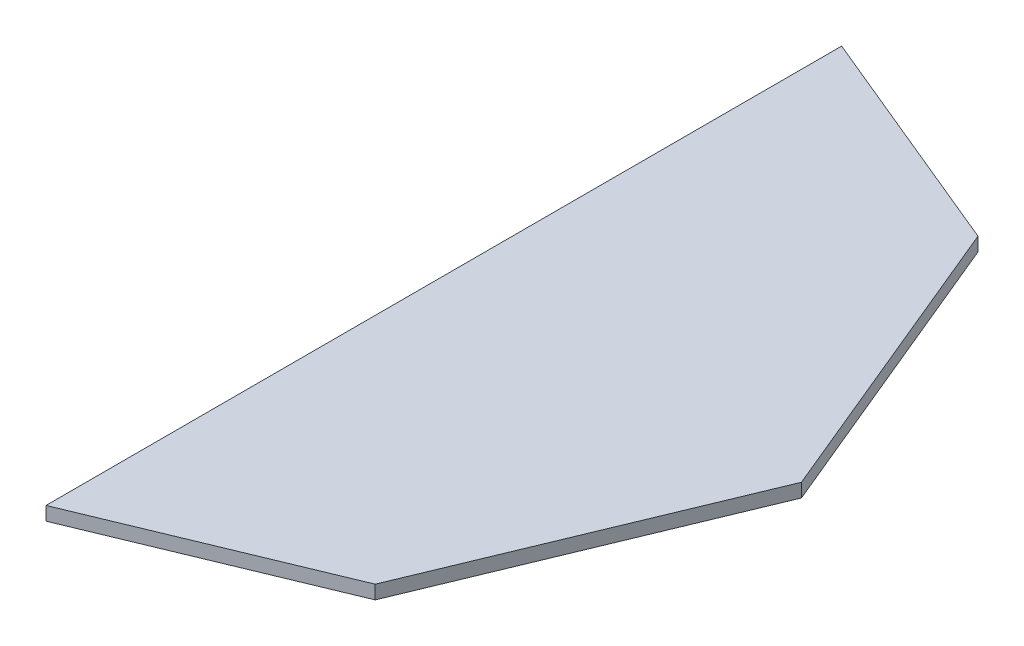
SolidWorks part; units mm, degrees
ref_plane "Front" through (0, 0, 0) normal (0, 0, 1) x (1, 0, 0)
ref_plane "Top" through (0, 0, 0) normal (0, 1, 0) x (1, 0, 0)
ref_plane "Right" through (0, 0, 0) normal (1, 0, 0) x (0, 0, -1)
sketch "Sketch1" plane through (0, 0, 0) normal (0, 1, 0) x (1, 0, 0)
  line L0 (60.3553, 350) -> (60.3553, -350)
  line L1 (60.3553, -350) -> (265.165, -265.165)
  line L2 (265.165, -265.165) -> (375, 0)
  line L3 (375, 0) -> (265.165, 265.165)
  line L4 (265.165, 265.165) -> (60.3553, 350)
  line L10 (-132.5825, 320.0825) -> (-265.165, 265.165)
  line L11 (-320.0825, 132.5825) -> (-375, 0)
  line L12 (-320.0825, -132.5825) -> (-265.165, -265.165)
  line L13 (-132.5825, -320.0825) -> (0, -375)
  arc A0 (60.3553, -341.1571) -> (60.3553, 341.1571) centre (0, 0) ccw construction
  dimension "D1" = 700
extrude "Boss-Extrude1" add sketch "Sketch1" along normal blind 12 contours L0 L1 L2 L3 L4
